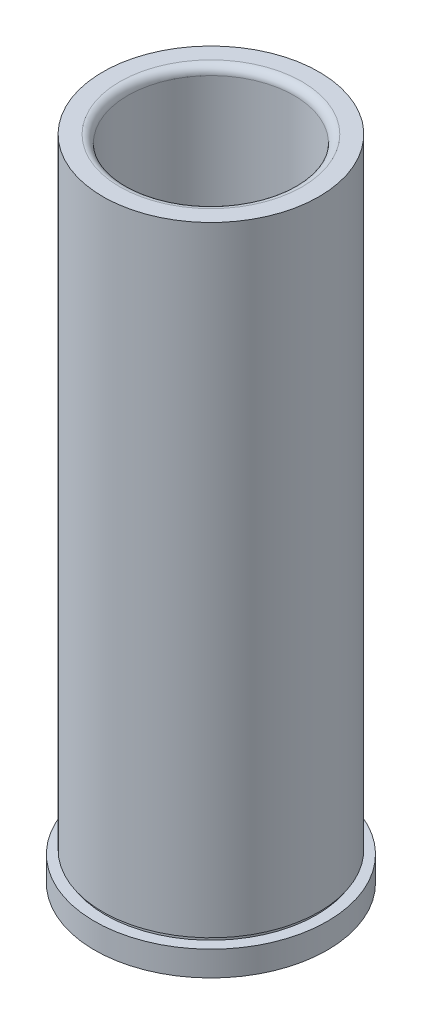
SolidWorks part; units mm, degrees
ref_plane "Front Plane" through (0, 0, 0) normal (0, 0, 1) x (1, 0, 0)
ref_plane "Top Plane" through (0, 0, 0) normal (0, 1, 0) x (1, 0, 0)
ref_plane "Right Plane" through (0, 0, 0) normal (1, 0, 0) x (0, 0, -1)
sketch "Sketch1" plane through (0, 0, 0) normal (0, 0, 1) x (1, 0, 0)
  line L0 (-813.1437, 0) -> (49186.8563, 0) construction
  line L1 (0, -1000) -> (0, 49000) construction
  line L2 (-15.8814, 123.825) -> (-15.8813, 60.325)
  line L4 (-22.225, 0) -> (-22.225, 4.7625)
  line L5 (-22.225, 4.7625) -> (-20.1358, 4.7625)
  line L6 (-20.6439, 123.825) -> (-20.6438, 5.5245)
  line L7 (-20.6439, 123.825) -> (-15.8814, 123.825)
  line L8 (-17.1513, 59.055) -> (-17.1513, 0.7938)
  line L9 (-17.1513, 0.7938) -> (-17.9451, 0)
  line L10 (-20.6438, 5.5245) -> (-20.1358, 5.5245)
  line L11 (-20.1358, 5.5245) -> (-20.1358, 4.7625)
  line L12 (-17.9451, 0) -> (-22.225, 0)
  arc A0 (-15.8813, 60.325) -> (-17.1513, 59.055) centre (-15.8813, 59.055) ccw
  dimension "D1" = 0.508
  dimension "OD" = 41.2877
  dimension "ID" = 31.7627
  dimension "FLANGETHICKNESS" = 4.7625
  dimension "FLANGEDIA" = 44.45
  dimension "D2" = 1.27
  dimension "D3" = 0.762
  dimension "D4" = 45
  dimension "D5" = 0.7937
  dimension "D6" = 123.825
  dimension "D7" = 63.5
revolve "Revolve1" add sketch "Sketch1" angle 360 about L1
fillet "Fillet1" radius 1.524 1 edges at (15.8813, 123.825, 0)
